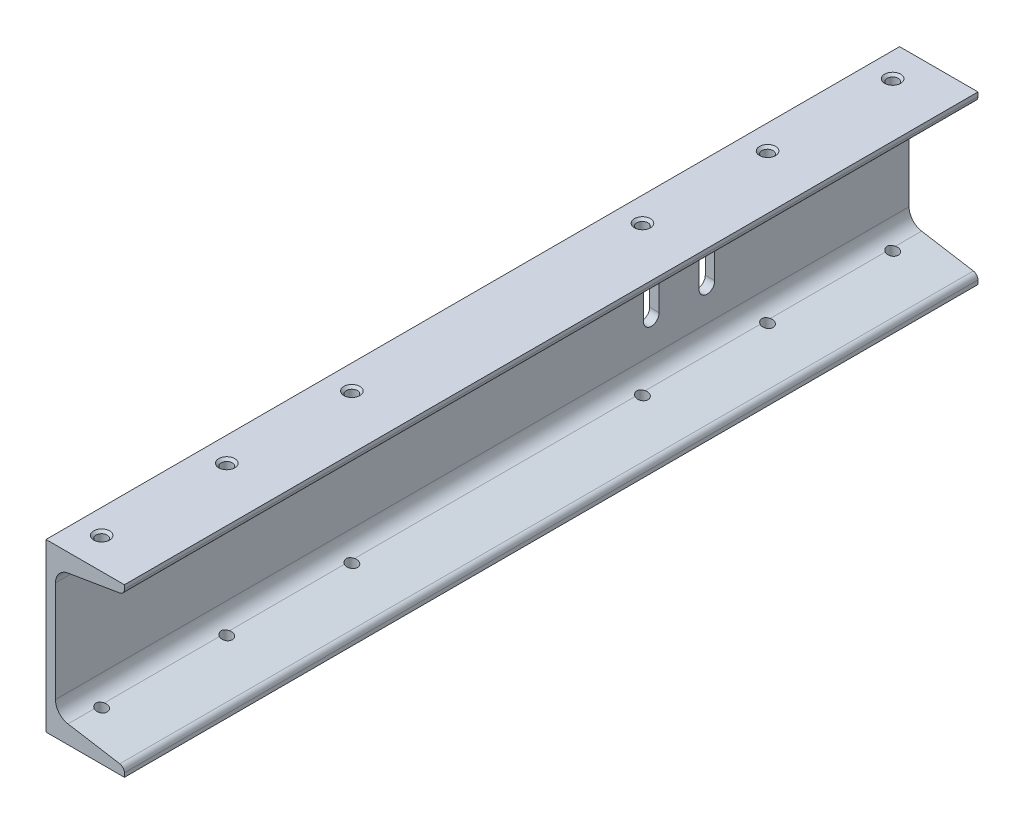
SolidWorks part; units mm, degrees
ref_plane "Front" through (0, 0, 0) normal (0, 0, 1) x (1, 0, 0)
ref_plane "Top" through (0, 0, 0) normal (0, 1, 0) x (1, 0, 0)
ref_plane "Right" through (0, 0, 0) normal (1, 0, 0) x (0, 0, -1)
sketch "Sketch1" plane through (0, 0, 0) normal (0, 0, 1) x (1, 0, 0)
  line L0 (0, 0) -> (0, 76.2)
  line L1 (0, 76.2) -> (35.814, 76.2)
  line L2 (0, 0) -> (35.814, 0)
  line L12 (4.318, 61.1765) -> (4.318, 15.0235)
  line L15 (35.814, 76.2) -> (35.814, 74.3874)
  line L16 (35.814, 0) -> (35.814, 1.8126)
  line L17 (10.0485, 67.9412) -> (33.6916, 71.882)
  line L18 (10.0485, 8.2588) -> (33.6916, 4.318)
  arc A9 (4.318, 15.0235) -> (10.0485, 8.2588) centre (11.176, 15.0235) ccw
  arc A10 (4.318, 61.1765) -> (10.0485, 67.9412) centre (11.176, 61.1765) cw
  arc A11 (35.814, 74.3874) -> (33.6916, 71.882) centre (33.274, 74.3874) cw
  arc A12 (35.814, 1.8126) -> (33.6916, 4.318) centre (33.274, 1.8126) ccw
extrude "Boss-Extrude1" add sketch "Sketch1" along normal blind 389.8999
ref_plane "Plane1" through (0, 38.1, 0) normal (0, -1, 0) x (-1, 0, 0)
hole_wizard "1/4-20 Tapped Hole5" positions "Sketch8" profile "Sketch9" tap size "1/4-20" standard "ANSI Inch"
sketch "Sketch8" plane through (0, 76.2, 0) normal (0, 1, 0) x (1, 0, 0)
  line L0 (0, -389.8999) -> (0, 0) construction
  line L1 (17.907, -389.8999) -> (17.907, -247.0249) construction
  line L2 (35.814, -389.8999) -> (0, -389.8999) construction
  line L4 (17.907, -318.4624) -> (-23.7625, -318.4624) construction
  line L6 (0, -194.95) -> (121.2198, -194.95) construction
  point P0 (11.1252, -261.3124)
  point P2 (11.1252, -375.6124)
  point P4 (11.1252, -318.4624)
  point P22 (11.1252, -14.2875)
  point P23 (11.1252, -71.4375)
  point P24 (11.1252, -128.5875)
  dimension "D1" = 11.1252
  dimension "D2" = 142.875
  dimension "D3" = 57.15
  dimension "D4" = 57.15
sketch "Sketch9" plane through (11.1252, 76.2, 261.3124) normal (1, 0, 0) x (0, 0, 1)
  line L0 (0, 0) -> (0, 62.7103)
  line L1 (0, 62.7103) -> (2.5527, 61.1765)
  line L2 (2.5527, 61.1765) -> (2.5527, 1.1049)
  line L3 (2.5527, 1.1049) -> (3.6576, 0)
  line L5 (3.6576, 0) -> (0, 0)
  line L6 (-2.5527, 1.1049) -> (-3.6576, 0) construction
  line L10 (0, 62.7103) -> (-2.5527, 61.1765) construction
  line L11 (0, -6.35) -> (0, 107.95) construction
  dimension "Tap Drill Dia." = 5.1054
  dimension "Tap Drill Depth" = 61.1765
  dimension "Near C'Sink Dia." = 7.3152
  dimension "Near C'Sink Angle" = 90
  dimension "Drill Angle" = 118
sketch "Sketch10" plane through (0, 0, 0) normal (-1, 0, 0) x (0, 0, 1)
  line L2 (-123.317, 44.6613) -> (79.883, 44.6613) construction
  line L3 (79.883, 44.6613) -> (79.883, 76.2) construction
  line L4 (0, 76.2) -> (130.175, 76.2) construction
  line L7 (389.8999, 76.2) -> (0, 76.2) construction
  line L8 (92.329, 30.1625) -> (92.329, 46.0375) construction
  line L11 (88.7603, 30.1625) -> (88.7603, 46.0375)
  line L15 (130.175, 31.75) -> (-543.5271, 31.75) construction
  line L16 (130.175, 31.75) -> (130.175, 76.2) construction
  line L17 (95.8977, 30.1625) -> (95.8977, 46.0375)
  line L18 (117.729, 30.1625) -> (117.729, 46.0375) construction
  line L19 (114.1603, 30.1625) -> (114.1603, 46.0375)
  line L20 (121.2977, 30.1625) -> (121.2977, 46.0375)
  arc A4 (88.7603, 30.1625) -> (95.8977, 30.1625) centre (92.329, 30.1625) ccw
  arc A5 (95.8977, 46.0375) -> (88.7603, 46.0375) centre (92.329, 46.0375) ccw
  arc A6 (114.1603, 30.1625) -> (121.2977, 30.1625) centre (117.729, 30.1625) ccw
  arc A7 (121.2977, 46.0375) -> (114.1603, 46.0375) centre (117.729, 46.0375) ccw
  point P7 (92.329, 38.1)
  point P17 (117.729, 38.1)
  dimension "D1" = 7.1374
  dimension "D2" = 15.875
  dimension "D3" = 7.1374
  dimension "D4" = 15.875
  dimension "D5" = 25.4
  dimension "D6" = 12.446
  dimension "D7" = 12.446
  dimension "D8" = 38.1
extrude "Cut-Extrude2" cut sketch "Sketch10" against normal through all
mirror "Mirror1" about plane through (0, 38.1, 0) normal (0, -1, 0) of "1/4-20 Tapped Hole5"
